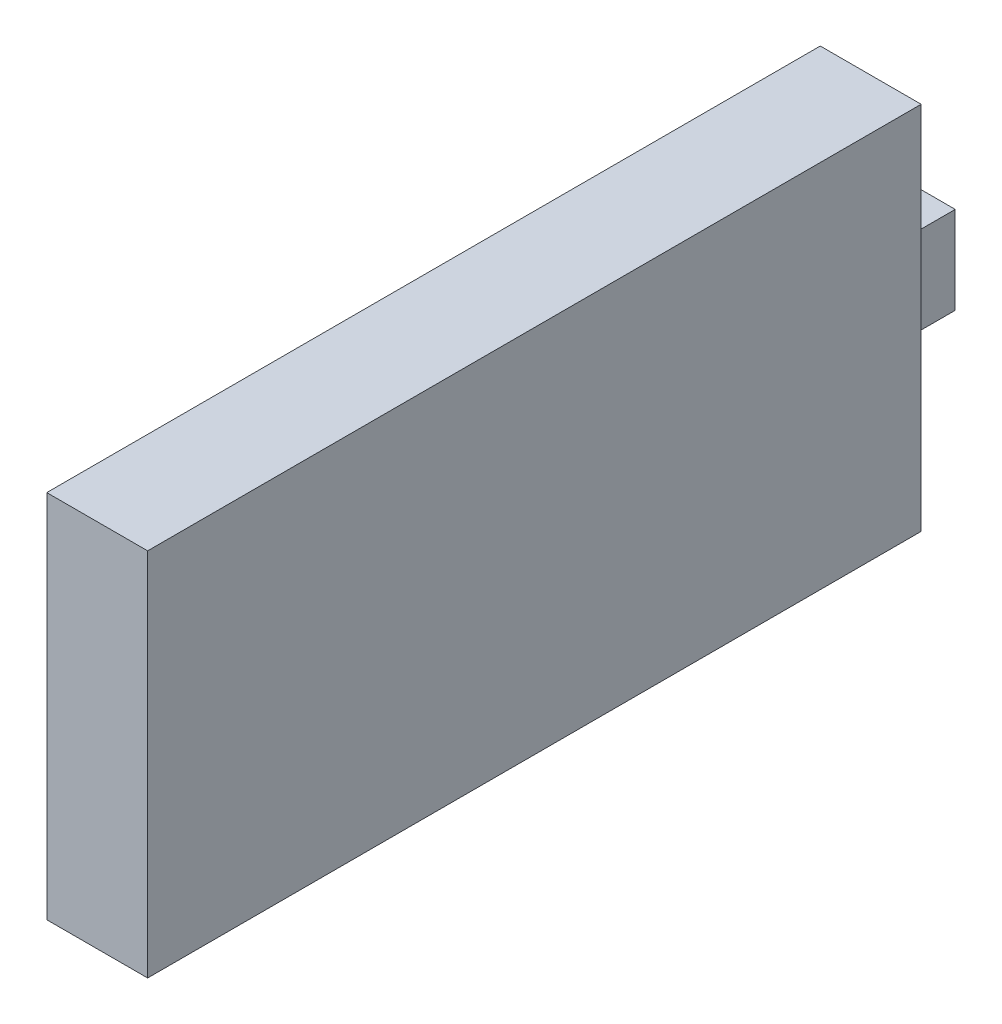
SolidWorks part; units mm, degrees
ref_plane "Ebene vorne" through (0, 0, 0) normal (0, 0, 1) x (1, 0, 0)
ref_plane "Ebene oben" through (0, 0, 0) normal (0, 1, 0) x (1, 0, 0)
ref_plane "Ebene rechts" through (0, 0, 0) normal (1, 0, 0) x (0, 0, -1)
sketch "Skizze2" plane through (0, 0, 0) normal (0, 1, 0) x (1, 0, 0)
  line L0 (0, 0) -> (-129.1031, 0) construction
  line L1 (-57.0516, 57.5) -> (-72.0516, 57.5)
  line L2 (-57.0516, 57.5) -> (-57.0516, -57.5)
  line L3 (-57.0516, -57.5) -> (-72.0516, -57.5)
  line L4 (-72.0516, 57.5) -> (-72.0516, -57.5)
  line L5 (-72.0516, 57.5) -> (-57.0516, -57.5) construction
  point P7 (-64.5516, 0)
  dimension "D1" = 115
  dimension "D2" = 15
extrude "Aufsatz-Linear austragen1" add sketch "Skizze2" along normal blind 55
sketch "Skizze3" plane through (0, 0, -57.5) normal (0, 0, -1) x (-1, 0, 0)
  line L0 (70.9817, 27.5) -> (61.9817, 27.5) construction
  line L1 (61.9817, 21) -> (70.9817, 21)
  line L2 (61.9817, 21) -> (61.9817, 34)
  line L3 (61.9817, 34) -> (70.9817, 34)
  line L4 (70.9817, 21) -> (70.9817, 34)
  line L6 (72.0516, 55) -> (72.0516, 0) construction
  line L7 (72.0516, 55) -> (72.0516, 0) construction
  line L8 (72.0516, 27.5) -> (57.0516, 27.5) construction
  line L9 (57.0516, 55) -> (57.0516, 0) construction
  dimension "D1" = 13
  dimension "D2" = 9
extrude "Aufsatz-Linear austragen2" add sketch "Skizze3" along normal blind 10 contours L2 L3 L4 L1
